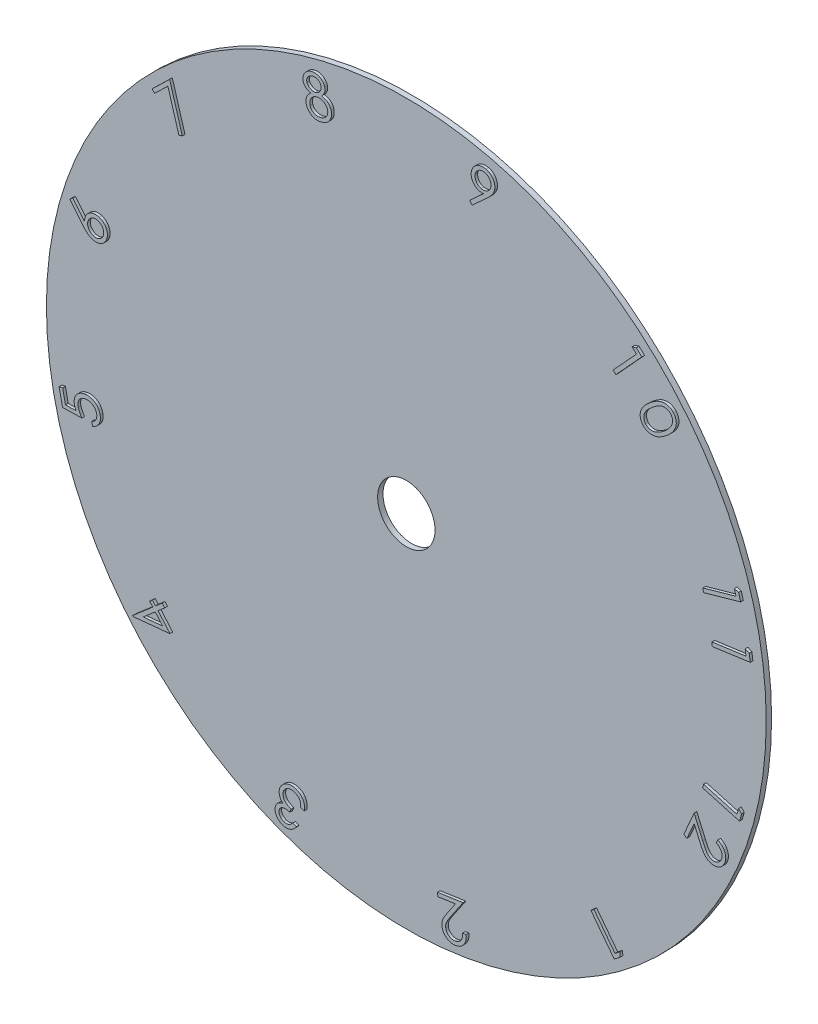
SolidWorks part; units mm, degrees
ref_plane "Front" through (0, 0, 0) normal (0, 0, 1) x (1, 0, 0)
ref_plane "Top" through (0, 0, 0) normal (0, 1, 0) x (1, 0, 0)
ref_plane "Right" through (0, 0, 0) normal (1, 0, 0) x (0, 0, -1)
sketch "Sketch1" plane through (0, 0, 0) normal (0, 0, 1) x (1, 0, 0)
  circle A0 centre (0, 0) radius 134.3557
extrude "Base-Extrude" add sketch "Sketch1" along normal blind 2
sketch "Sketch2" plane through (0, 0, 2) normal (0, 0, 1) x (1, 0, 0)
  circle A2 centre (0, 0) radius 116.3557
  circle A3 centre (0, 0) radius 116.3557 construction
  text T0 "  12    1    2    3    4    5    6    7    8    9    10   11 " font "Century Gothic" height 15
  dimension "D1" = 18
extrude "Boss-Extrude1" add sketch "Sketch2" along normal blind 1
sketch "Sketch3" plane through (0, 0, 2) normal (0, 0, 1) x (1, 0, 0)
  circle A0 centre (0, 0) radius 10.7111
extrude "Cut-Extrude1" cut sketch "Sketch3" against normal through all
